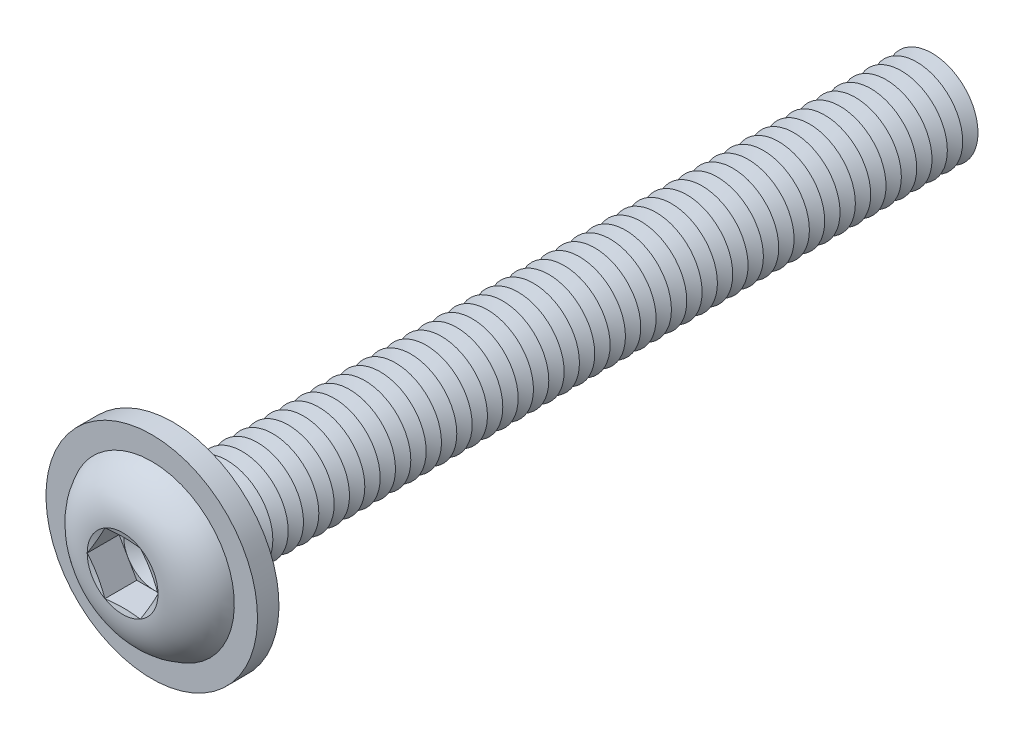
SolidWorks part; units mm, degrees
ref_plane "Front Plane" through (0, 0, 0) normal (0, 0, 1) x (1, 0, 0)
ref_plane "Top Plane" through (0, 0, 0) normal (0, 1, 0) x (1, 0, 0)
ref_plane "Right Plane" through (0, 0, 0) normal (1, 0, 0) x (0, 0, -1)
sketch "Sketch1" plane through (0, 0, 0) normal (1, 0, 0) x (0, 0, -1)
  line L0 (0, 1.5) -> (0, 2.85)
  line L3 (0, 1.5) -> (25, 1.5)
  line L4 (25, 1.5) -> (25, 0)
  line L5 (25, 0) -> (-1.65, 0) construction
  line L6 (-1.65, 0) -> (25, 0)
  line L7 (-1.65, 1.1547) -> (-1.65, 0.5773) construction
  line L8 (-1.65, 0.5773) -> (-1.65, 0)
  line L9 (-1.65, 1.1547) -> (-1.4953, 0.5773)
  line L10 (-1.4953, 0.5773) -> (-1.65, 0.5773)
  line L11 (25, 0) -> (22.7481, 0) construction
  line L12 (0, 2.85) -> (-1.65, 2.85) construction
  arc A1 (0, 2.85) -> (-1.65, 1.1547) centre (0, 1.1994) ccw
  point P8 (25, 0.75)
  dimension "D1" = 5.7
  dimension "D2" = 3
  dimension "D3" = 1.65
  dimension "D4" = 2.3094
  dimension "D5" = 25
  dimension "D6" = 15
revolve "Revolve1" add sketch "Sketch1" angle 360 about L5
fillet "Fillet1" radius 0.25 1 edges at (-1.5, 0, 0)
sketch "Sketch2" plane through (0, 0, 0) normal (1, 0, 0) x (0, 0, -1)
  line L0 (24.75, 1.5) -> (25.25, 1.5)
  line L1 (25, 1.5) -> (0.25, 1.5) construction
  line L2 (25.25, 1.5) -> (25, 1.067)
  line L3 (25, -1.5) -> (25, 1.5) construction
  line L4 (25, 1.067) -> (24.75, 1.5)
  dimension "D1" = 0.5
revolve "Cut-Revolve1" cut sketch "Sketch2" angle 360 about axis through (0, 0, -25) along (0, 0, -1)
pattern_linear "LPattern1" count 50 spacing 0.5 along (0, 0, 1) of "Cut-Revolve1"
sketch "Sketch3" plane through (0, 0, 1.65) normal (0, 0, 1) x (1, 0, 0)
  line L7 (0.5773, 1) -> (-0.5774, 1)
  line L8 (-0.5774, 1) -> (-1.1547, 0)
  line L9 (-1.1547, 0) -> (-0.5773, -1)
  line L10 (-0.5773, -1) -> (0.5773, -1)
  line L11 (0.5773, -1) -> (1.1547, 0)
  line L12 (1.1547, 0) -> (0.5773, 1)
  circle A0 centre (0, 0) radius 1 construction
  circle A3 centre (0, 0) radius 1.1547 construction
extrude "Cut-Extrude1" cut sketch "Sketch3" against normal blind 1.04
sketch "Sketch4" plane through (0, 0, 0.61) normal (0, 0, 1) x (1, 0, 0)
  line L1 (0.5773, 1) -> (-0.5774, 1) construction
  circle A0 centre (0, 0) radius 1
extrude "Cut-Extrude2" cut sketch "Sketch4" against normal through all draft 60
sketch "Sketch5" plane through (0, 0, 0) normal (0, 0, -1) x (-1, 0, 0)
  circle A0 centre (0, 0) radius 3.45
  circle A1 centre (0, 0) radius 1.75
  circle A2 centre (0, 0) radius 1.75 construction
  dimension "D1" = 6.9
extrude "Boss-Extrude1" add sketch "Sketch5" against normal blind 0.7
